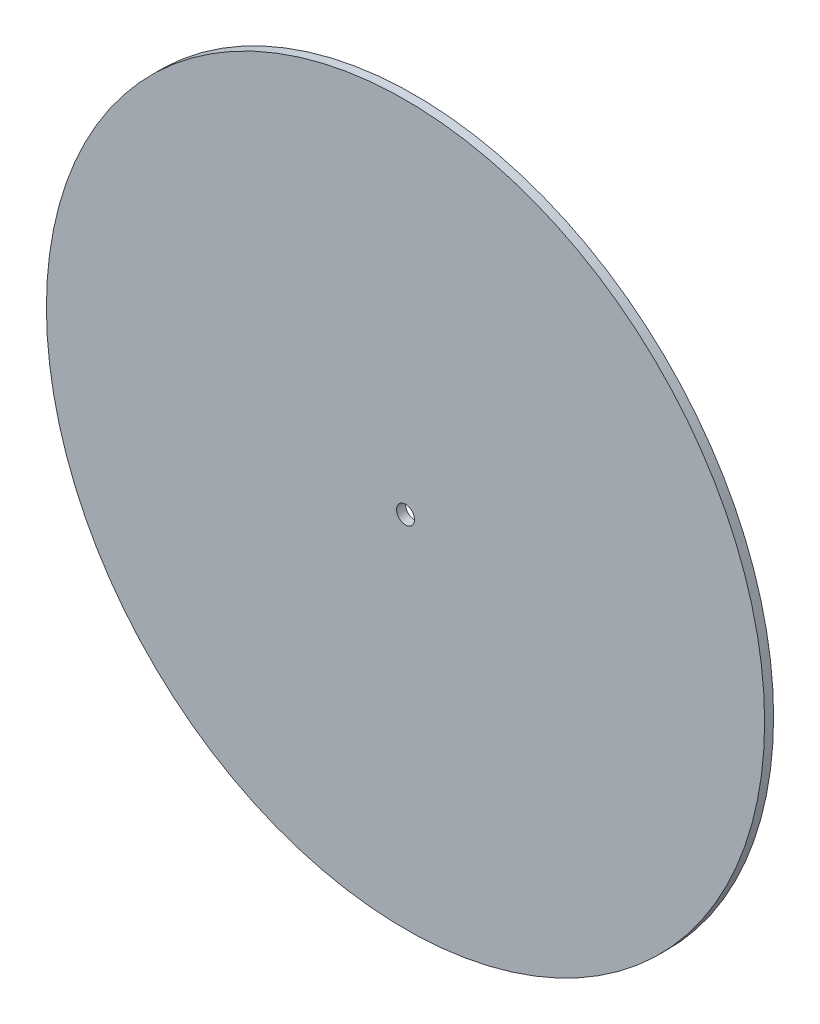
SolidWorks part; units mm, degrees
ref_plane "Front Plane" through (0, 0, 0) normal (0, 0, 1) x (1, 0, 0)
ref_plane "Top Plane" through (0, 0, 0) normal (0, 1, 0) x (1, 0, 0)
ref_plane "Right Plane" through (0, 0, 0) normal (1, 0, 0) x (0, 0, -1)
sketch "Sketch1" plane through (0, 0, 0) normal (0, 0, 1) x (1, 0, 0)
  circle A0 centre (0, 0) radius 40
  circle A1 centre (0, 0) radius 1
  dimension "D1" = 80
  dimension "D2" = 2
extrude "Boss-Extrude1" add sketch "Sketch1" along normal blind 1
